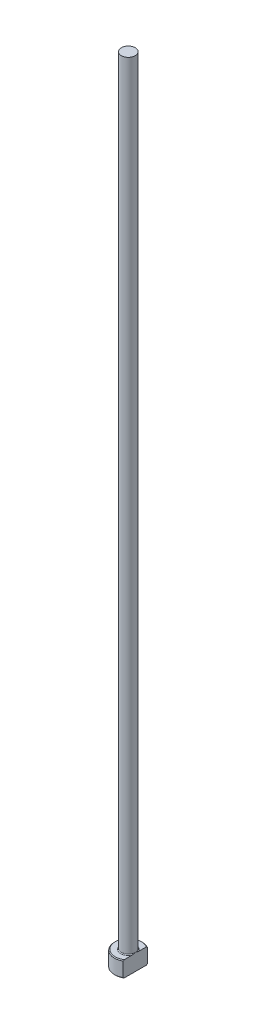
SolidWorks part; units mm, degrees
ref_plane "Front Plane" through (0, 0, 0) normal (0, 0, 1) x (1, 0, 0)
ref_plane "Top Plane" through (0, 0, 0) normal (0, 1, 0) x (1, 0, 0)
ref_plane "Right Plane" through (0, 0, 0) normal (1, 0, 0) x (0, 0, -1)
sketch "Sketch1" plane through (0, 0, 0) normal (0, 0, 1) x (1, 0, 0)
  line L0 (0, 259.9588) -> (0, -15.1925) construction
  line L1 (0, 0) -> (-3.5, 0)
  line L2 (-3.5, 0) -> (-3.5, 4)
  line L3 (-3.5, 4) -> (-1.75, 4)
  line L4 (-1.75, 4) -> (-1.75, 200)
  line L5 (-1.75, 200) -> (0, 200)
  line L6 (0, 200) -> (0, 0)
  dimension "L" = 200
  dimension "H" = 7
  dimension "T" = 4
  dimension "D" = 3.5
revolve "Revolve1" add sketch "Sketch1" angle 360 about L0
chamfer "Chamfer1" distance 0.2 angle 45 2 edges at (0, 4, 3.5) (0, 0, 3.5)
fillet "Fillet1" radius 0.2 1 edges at (0, 4, 1.75)
sketch "Sketch2" plane through (0, 0, 0) normal (0, 1, 0) x (1, 0, 0)
  line L0 (1.75, -3.0311) -> (1.75, 3.0311)
  circle A0 centre (0, 0) radius 3.5 construction
  arc A1 (1.75, -3.0311) -> (1.75, 3.0311) centre (0, 0) ccw
  circle A2 centre (0, 0) radius 1.75 construction
extrude "KEYED HEAD" cut sketch "Sketch2" along normal through all
